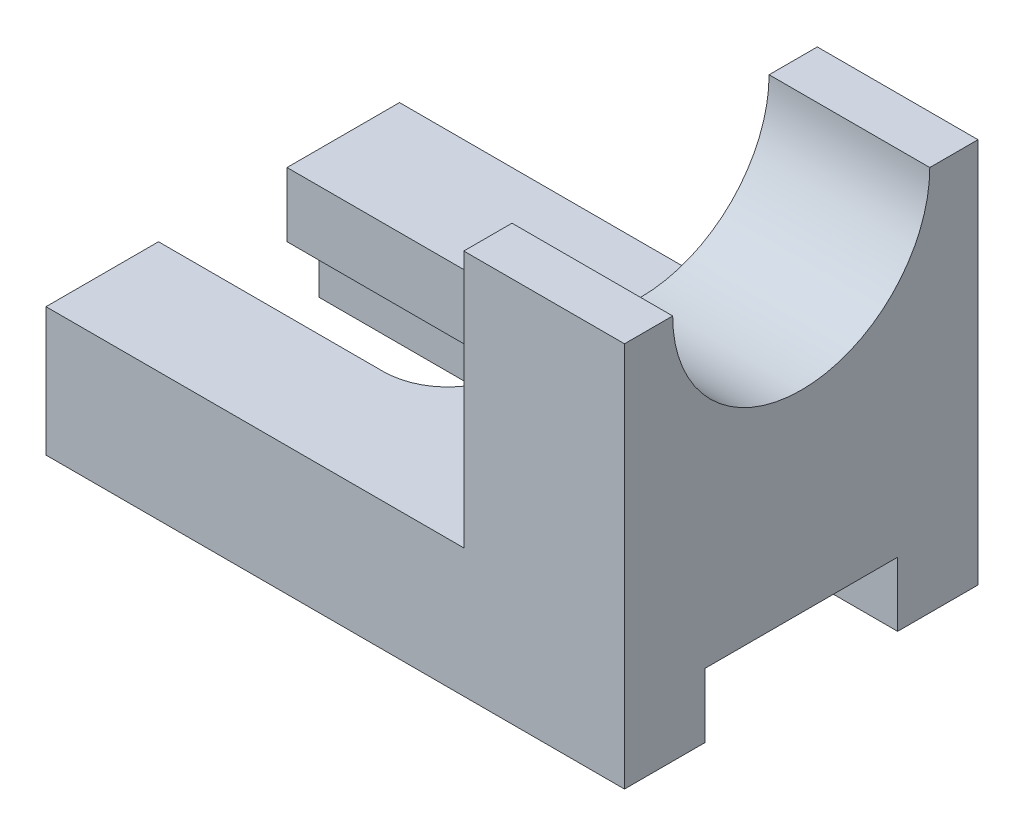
SolidWorks part; units mm, degrees
ref_plane "前视基准面" through (0, 0, 0) normal (0, 0, 1) x (1, 0, 0)
ref_plane "上视基准面" through (0, 0, 0) normal (0, 1, 0) x (1, 0, 0)
ref_plane "右视基准面" through (0, 0, 0) normal (1, 0, 0) x (0, 0, -1)
sketch "草图1" plane through (0, 0, 0) normal (0, 1, 0) x (1, 0, 0)
  line L0 (0, 27.5) -> (35, 27.5) construction
  line L1 (0, 0) -> (90, 0)
  line L2 (0, 0) -> (0, 17.5)
  line L3 (0, 55) -> (90, 55)
  line L4 (90, 0) -> (90, 55)
  line L5 (0, 17.5) -> (35, 17.5)
  line L6 (0, 37.5) -> (35, 37.5)
  line L7 (0, 37.5) -> (0, 55)
  arc A1 (35, 17.5) -> (35, 37.5) centre (35, 27.5) ccw
  dimension "D1" = 90
  dimension "D2" = 55
  dimension "D5" = 35
  dimension "D3" = 10
  dimension "D4" = 10
extrude "拉伸1" add sketch "草图1" along normal blind 20
sketch "草图2" plane through (0, 20, 0) normal (0, 1, 0) x (1, 0, 0)
  line L0 (90, 55) -> (0, 55) construction
  line L1 (65, 55) -> (90, 55)
  line L2 (65, 55) -> (65, 0)
  line L3 (65, 0) -> (90, 0)
  line L4 (90, 55) -> (90, 0)
  dimension "D1" = 25
extrude "拉伸2" add sketch "草图2" along normal blind 40
sketch "草图3" plane through (90, 0, 0) normal (1, 0, 0) x (0, 0, -1)
  line L0 (0, 60) -> (55, 60) construction
  line L1 (0, 0) -> (55, 0) construction
  line L2 (12.5, 0) -> (42.5, 0)
  line L3 (12.5, 0) -> (12.5, 10)
  line L4 (12.5, 10) -> (42.5, 10)
  line L5 (42.5, 0) -> (42.5, 10)
  line L6 (27.5, 20) -> (27.5, 24.6698) construction
  line L7 (55, 20) -> (0, 20) construction
  circle A0 centre (27.5, 60) radius 20
  dimension "D1" = 40
  dimension "D2" = 30
  dimension "D3" = 10
extrude "切除-拉伸1" cut sketch "草图3" against normal through all
